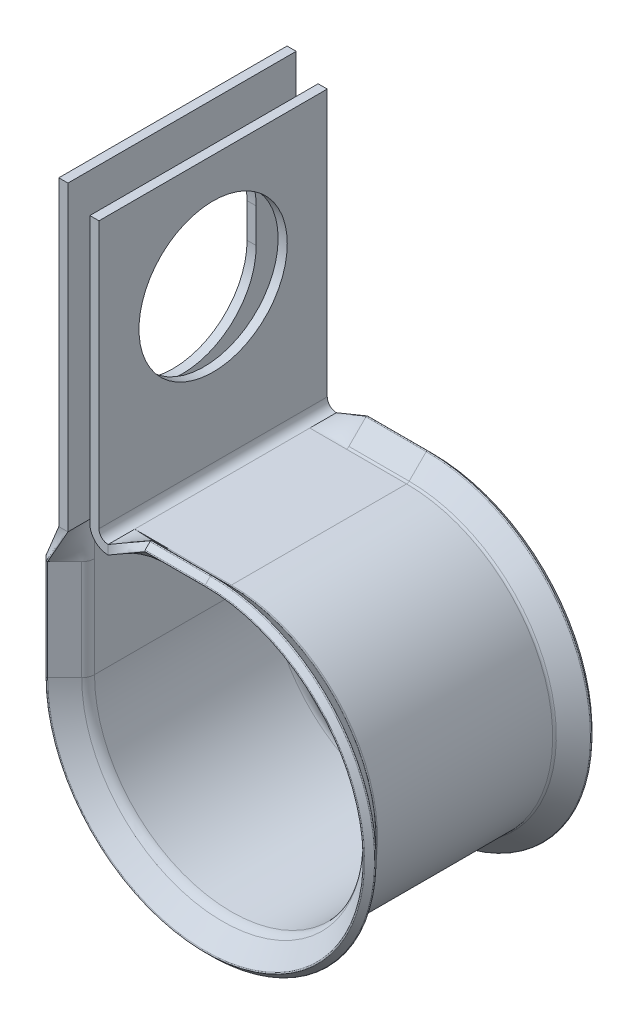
SolidWorks part; units mm, degrees
ref_plane "Front Plane" through (0, 0, 0) normal (0, 0, 1) x (1, 0, 0)
ref_plane "Top Plane" through (0, 0, 0) normal (0, 1, 0) x (1, 0, 0)
ref_plane "Right Plane" through (0, 0, 0) normal (1, 0, 0) x (0, 0, -1)
sketch "Sketch1" plane through (0, 0, 0) normal (0, 0, 1) x (1, 0, 0)
  line L0 (0, -21.4122) -> (0, 9.1186)
  line L1 (9.525, -11.8872) -> (2.794, -11.8872)
  line L2 (1.524, -10.6172) -> (1.524, 7.9248)
  arc A0 (0, -21.4122) -> (9.525, -11.8872) centre (9.525, -21.4122) ccw
  arc A1 (2.794, -11.8872) -> (1.524, -10.6172) centre (2.794, -10.6172) cw
  dimension "D3" = 1.27
  dimension "D Clamp Diameter" = 19.05
  dimension "L Center to Center" = 21.4122
  dimension "F Slot Center to End" = 9.1186
  dimension "E Hole Center to End" = 7.9248
  dimension "D6" = 1.524
extrude "Extrude-Thin1" add sketch "Sketch1" along normal mid plane 15.875 thin
sketch "Sketch2" plane through (2.159, 0, 0) normal (1, 0, 0) x (0, 0, -1)
  circle A0 centre (0, 0) radius 5.1562
  dimension "H Hole Diameter" = 10.3124
extrude "Cut-Extrude1" cut sketch "Sketch2" against normal up to next
sketch "Sketch3" plane through (-0.635, 0, 0) normal (-1, 0, 0) x (0, 0, 1)
  line L0 (0, -1.1938) -> (0, 1.1938) construction
  line L1 (-5.1562, -1.1938) -> (-5.1562, 1.1938)
  line L2 (5.1562, -1.1938) -> (5.1562, 1.1938)
  arc A0 (-5.1562, -1.1938) -> (5.1562, -1.1938) centre (0, -1.1938) ccw
  arc A1 (5.1562, 1.1938) -> (-5.1562, 1.1938) centre (0, 1.1938) ccw
  point P2 (0, 0)
  dimension "H Slot Width" = 10.3124
  dimension "S Slot Length" = 12.7
extrude "Cut-Extrude2" cut sketch "Sketch3" against normal up to next
sketch "Sketch4" plane through (0, 0, 0) normal (0, 0, 1) x (1, 0, 0)
  line L0 (2.794, -11.8872) -> (9.525, -11.8872)
  line L1 (0, -21.4122) -> (0, -11.8872)
  line L2 (0, 9.1186) -> (0, -21.4122) construction
  arc A0 (9.525, -11.8872) -> (0, -21.4122) centre (9.525, -21.4122) cw
ref_plane "Plane1" through (2.794, 0, 0) normal (1, 0, 0) x (0, 0, -1)
sketch "Sketch5" plane through (2.794, 0, 0) normal (1, 0, 0) x (0, 0, -1)
  line L3 (-7.9375, -11.2522) -> (-5.9055, -11.2522)
  line L4 (-7.9375, -11.2522) -> (-7.9375, -11.8872)
  line L5 (-7.9375, -11.8872) -> (-5.9055, -11.8872)
  line L6 (-5.9055, -11.2522) -> (-5.9055, -11.8872)
  line L7 (7.9375, -11.2522) -> (5.9055, -11.2522)
  line L8 (7.9375, -11.2522) -> (7.9375, -11.8872)
  line L9 (7.9375, -11.8872) -> (5.9055, -11.8872)
  line L10 (5.9055, -11.2522) -> (5.9055, -11.8872)
  dimension "D1" = 0.635
  dimension "D2" = 2.032
  dimension "D3" = 2.032
  dimension "D4" = 0.635
sweep "Cut-Sweep1" cut profiles "Sketch5" path "Sketch4"
sketch "Sketch6" plane through (2.794, 0, 0) normal (1, 0, 0) x (0, 0, -1)
  line L0 (-5.9055, -11.8872) -> (-5.9055, -11.2522)
  line L1 (7.9028, -10.3337) -> (7.5616, -9.9924)
  line L2 (-5.9055, -11.2522) -> (-6.0888, -11.2522)
  line L3 (7.9028, -10.4414) -> (6.7174, -11.6268)
  line L4 (6.2684, -11.1778) -> (7.4538, -9.9924)
  line L5 (-6.2684, -11.1778) -> (-7.4538, -9.9924)
  line L6 (5.9055, -11.8872) -> (6.0888, -11.8872)
  line L7 (-7.9028, -10.4414) -> (-6.7174, -11.6268)
  line L8 (5.9055, -11.2522) -> (6.0888, -11.2522)
  line L9 (-5.9055, -11.2522) -> (5.9055, -11.2522) construction
  line L10 (5.9055, -11.8872) -> (5.9055, -11.2522)
  line L11 (-6.194, -11.2522) -> (-7.3281, -10.1181) construction
  line L14 (-7.7771, -10.5671) -> (-6.3879, -11.9563) construction
  line L15 (-7.9028, -10.3337) -> (-7.5616, -9.9924)
  line L16 (-8.1363, -10.5671) -> (-7.3281, -9.7589) construction
  line L17 (0, -11.2522) -> (0, -10.6172) construction
  line L18 (-7.9375, -10.6172) -> (7.9375, -10.6172) construction
  line L19 (-8.1363, -10.5671) -> (-6.5675, -12.1359) construction
  line L20 (-6.0888, -10.9982) -> (-7.3281, -9.7589) construction
  line L21 (-7.7771, -10.5671) -> (-7.3281, -10.1181) construction
  line L22 (-5.9055, -11.2522) -> (-6.194, -11.2522) construction
  line L23 (-5.9055, -11.8872) -> (-6.0888, -11.8872)
  line L27 (-5.6515, -10.9982) -> (-6.0888, -10.9982) construction
  line L28 (-5.6515, -11.8872) -> (-5.6515, -10.9982) construction
  arc A0 (-7.9028, -10.4414) -> (-7.9028, -10.3337) centre (-7.8489, -10.3875) cw
  arc A1 (-7.5616, -9.9924) -> (-7.4538, -9.9924) centre (-7.5077, -10.0463) cw
  arc A2 (-6.2684, -11.1778) -> (-6.0888, -11.2522) centre (-6.0888, -10.9982) ccw
  arc A3 (-6.7174, -11.6268) -> (-6.0888, -11.8872) centre (-6.0888, -10.9982) ccw
  arc A4 (7.5616, -9.9924) -> (7.4538, -9.9924) centre (7.5077, -10.0463) ccw
  arc A5 (7.9028, -10.4414) -> (7.9028, -10.3337) centre (7.8489, -10.3875) ccw
  arc A6 (6.2684, -11.1778) -> (6.0888, -11.2522) centre (6.0888, -10.9982) cw
  arc A7 (6.7174, -11.6268) -> (6.0888, -11.8872) centre (6.0888, -10.9982) cw
  dimension "D4" = 0.254
  dimension "D5" = 0.889
  dimension "D6" = 0.0762
  dimension "D8" = 0.4826
  dimension "D2" = 135
  dimension "D7" = 1.6764
  dimension "D3" = 0.1833
  dimension "D9" = 1.6764
sketch "Sketch7" plane through (0, 0, 0) normal (0, 0, 1) x (1, 0, 0)
  line L0 (2.794, -11.8872) -> (9.525, -11.8872)
  line L1 (2.794, -11.8872) -> (2.794, -11.2522) construction
  line L2 (2.794, -11.8872) -> (2.794, -11.6268) construction
  line L3 (0, -21.4122) -> (0, -11.8872)
  arc A0 (9.525, -11.8872) -> (0, -21.4122) centre (9.525, -21.4122) cw
sweep "Sweep1" add profiles "Sketch6" path "Sketch7"
sketch "Sketch8" plane through (-0.635, 0, 0) normal (-1, 0, 0) x (0, 0, 1)
  line L0 (-6.0888, -21.4122) -> (-6.0888, -11.8872) construction
  line L1 (-7.9375, -11.8872) -> (-6.0888, -11.8872)
  line L2 (-7.9375, -11.8872) -> (-7.9375, -14.4272)
  line L3 (-7.9375, -14.4272) -> (-6.0888, -14.4272)
  line L4 (-6.0888, -11.8872) -> (-6.0888, -14.4272)
  line L5 (6.0888, -21.4122) -> (6.0888, -11.8872) construction
  line L6 (7.9375, -11.8872) -> (6.0888, -11.8872)
  line L7 (7.9375, -11.8872) -> (7.9375, -14.4272)
  line L8 (7.9375, -14.4272) -> (6.0888, -14.4272)
  line L9 (6.0888, -11.8872) -> (6.0888, -14.4272)
  dimension "D1" = 2.54
  dimension "D2" = 2.54
extrude "Cut-Extrude3" cut sketch "Sketch8" against normal mid plane 5.08
loft "Loft1" add
loft "Loft2" add
ref_plane "Plane2" through (2.794, 0, 0) normal (1, 0, 0) x (0, 0, -1)
sketch "Sketch9" plane through (2.794, 0, 0) normal (1, 0, 0) x (0, 0, -1)
  line L0 (0, -0.4254) -> (0, -6.985) construction
  line L1 (-6.0888, -11.8872) -> (-8.6288, -11.8872)
  line L2 (-6.0888, -11.8872) -> (-6.0888, -9.3472)
  line L3 (-6.0888, -9.3472) -> (-8.6288, -9.3472)
  line L4 (-8.6288, -11.8872) -> (-8.6288, -9.3472)
  line L5 (8.6288, -11.8872) -> (8.6288, -9.3472)
  line L6 (6.0888, -11.8872) -> (8.6288, -11.8872)
  line L7 (6.0888, -11.8872) -> (6.0888, -9.3472)
  line L8 (6.0888, -9.3472) -> (8.6288, -9.3472)
  dimension "D1" = 2.54
  dimension "D2" = 2.54
extrude "Cut-Extrude4" cut sketch "Sketch9" along normal blind 2.54
sketch3d "3DSketch1"
  line L0 (2.794, -11.2522, 7.9375) -> (5.334, -9.9924, 7.4538)
loft "Loft3" add
sketch3d "3DSketch2"
  line L0 (2.794, -11.2522, -7.9375) -> (5.334, -9.9924, -7.5616)
  arc A0 (5.334, -9.9924, -7.5616) -> (5.334, -9.9924, -7.4538) centre (5.334, -10.0463, -7.5077) ccw construction
  point P8 (5.4102, -10.0463, -7.5077)
loft "Loft4" add
